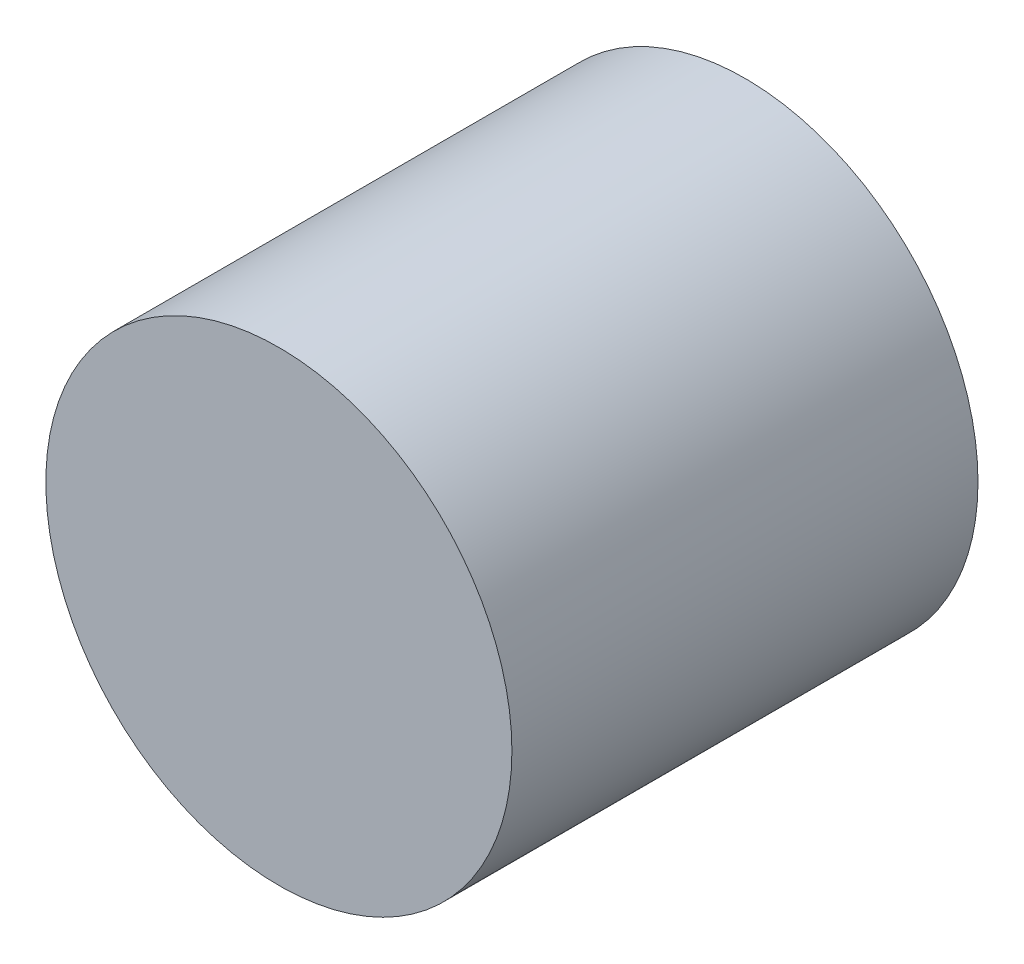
SolidWorks part; units mm, degrees
ref_plane "Plane1"
ref_plane "Plane2" through (0, 0, 0) normal (0, 1, 0) x (1, 0, 0)
ref_plane "Plane3" through (0, 0, 0) normal (1, 0, 0) x (0, 0, -1)
sketch "Sketch1" plane through (0, 0, 0) normal (0, 0, 1) x (1, 0, 0)
  circle A0 centre (0, 0) radius 5
  dimension "D1" = 10
extrude "Base-Extrude" add sketch "Sketch1" along normal mid plane 10
